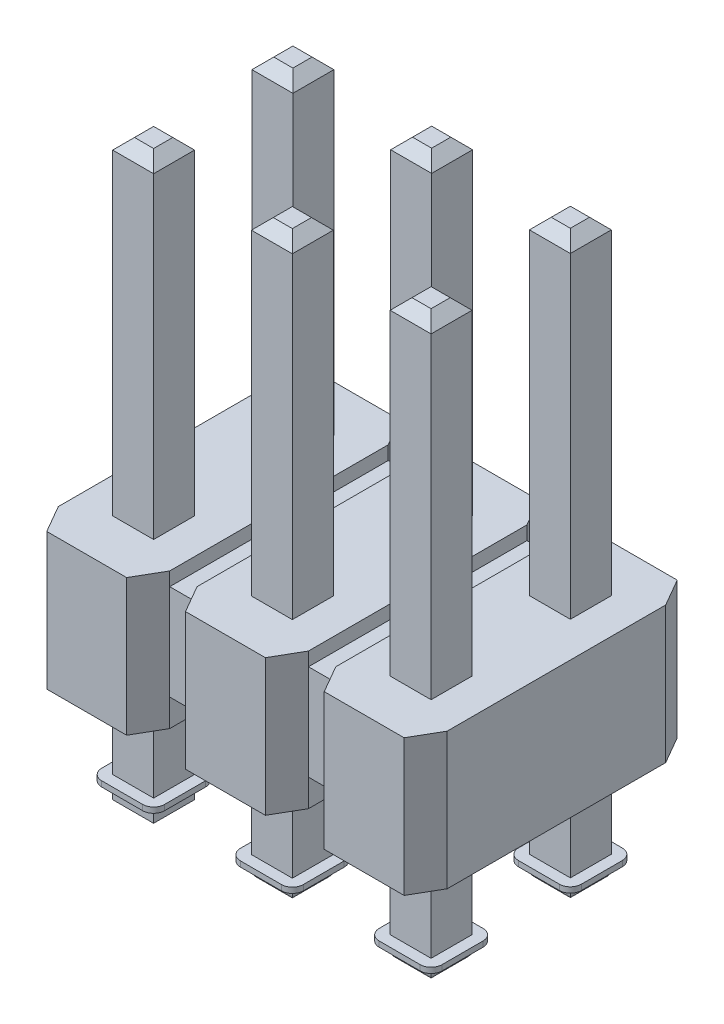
SolidWorks part; units mm, degrees
ref_plane "Plan de face" through (0, 0, 0) normal (0, 0, 1) x (1, 0, 0)
ref_plane "Plan de dessus" through (0, 0, 0) normal (0, 1, 0) x (1, 0, 0)
ref_plane "Plan de droite" through (0, 0, 0) normal (1, 0, 0) x (0, 0, -1)
sketch "Esquisse1" plane through (0, 0, 0) normal (0, 1, 0) x (1, 0, 0)
  line L0 (-0.7313, -2.5) -> (0.7313, -2.5)
  line L1 (0.7313, -2.5) -> (1.02, -2)
  line L2 (1.02, -2) -> (1.02, 2)
  line L3 (1.02, 2) -> (0.7313, 2.5)
  line L4 (0.7313, 2.5) -> (-0.7313, 2.5)
  line L5 (-0.7313, 2.5) -> (-1.02, 2)
  line L6 (-1.02, 2) -> (-1.02, -2)
  line L7 (-1.02, -2) -> (-0.7313, -2.5)
  point P8 (-1.02, 0)
  point P10 (0, -2.5)
  dimension "D1" = 2.04
  dimension "D2" = 5
  dimension "D3" = 150
  dimension "D4" = 150
  dimension "D5" = 150
  dimension "D6" = 150
  dimension "D7" = 0.5
  dimension "D8" = 0.5
extrude "Boss.-Extru.1" add sketch "Esquisse1" along normal blind 2.5
sketch "Esquisse2" plane through (0, 2.5, 0) normal (0, 1, 0) x (1, 0, 0)
  line L0 (0, 0.9) -> (0, -0.9) construction
  line L1 (-0.375, 1.65) -> (0.375, 1.65)
  line L2 (-0.375, 1.65) -> (-0.375, 0.9)
  line L3 (-0.375, 0.9) -> (0.375, 0.9)
  line L4 (0.375, 1.65) -> (0.375, 0.9)
  line L5 (-0.375, -0.9) -> (0.375, -0.9)
  line L6 (-0.375, -0.9) -> (-0.375, -1.65)
  line L7 (-0.375, -1.65) -> (0.375, -1.65)
  line L8 (0.375, -0.9) -> (0.375, -1.65)
  point P10 (0, 0)
  dimension "D1" = 0.75
  dimension "D2" = 1.8
extrude "Boss.-Extru.2" add sketch "Esquisse2" along normal blind 6
sketch "Esquisse3" plane through (0, 0, 0) normal (0, -1, 0) x (1, 0, 0)
  line L1 (-0.375, 1.65) -> (0.375, 1.65)
  line L2 (-0.375, 1.65) -> (-0.375, 0.9)
  line L3 (-0.375, 0.9) -> (0.375, 0.9)
  line L4 (0.375, 1.65) -> (0.375, 0.9)
  line L5 (-0.375, -0.9) -> (0.375, -0.9)
  line L6 (-0.375, -0.9) -> (-0.375, -1.65)
  line L7 (-0.375, -1.65) -> (0.375, -1.65)
  line L8 (0.375, -0.9) -> (0.375, -1.65)
extrude "Boss.-Extru.3" add sketch "Esquisse3" along normal blind 1.6
sketch "Esquisse4" plane through (-1.02, 0, 0) normal (-1, 0, 0) x (0, 0, 1)
  line L0 (-2, 2.5) -> (-2, 0) construction
  line L1 (-2, 2.25) -> (2, 2.25)
  line L2 (-2, 2.25) -> (-2, 0.5)
  line L3 (-2, 0.5) -> (2, 0.5)
  line L4 (2, 2.25) -> (2, 0.5)
  line L5 (2, 2.5) -> (2, 0) construction
  line L6 (-2, 2.5) -> (2, 2.5) construction
  line L7 (-2, 0) -> (2, 0) construction
  dimension "D1" = 0.25
  dimension "D2" = 0.5
extrude "Boss.-Extru.4" add sketch "Esquisse4" along normal blind 0.25
sketch "Esquisse5" plane through (1.02, 0, 0) normal (1, 0, 0) x (0, 0, -1)
  line L1 (-2, 2.25) -> (2, 2.25)
  line L2 (-2, 2.25) -> (-2, 0.5)
  line L3 (-2, 0.5) -> (2, 0.5)
  line L4 (2, 2.25) -> (2, 0.5)
extrude "Boss.-Extru.5" add sketch "Esquisse5" along normal blind 0.25
chamfer "Chanfrein2" distance 0.2 angle 45 8 edges at (0, 8.5, -0.9) (-0.375, 8.5, -1.275) (0, 8.5, -1.65) (0.375, 8.5, -1.275) (0, 8.5, 1.65) (-0.375, 8.5, 1.275) (0, 8.5, 0.9) (0.375, 8.5, 1.275)
sketch "Esquisse6" plane through (0, -1.6, 0) normal (0, -1, 0) x (1, 0, 0)
  line L1 (-0.375, 1.85) -> (0.375, 1.85)
  line L2 (-0.575, 1.65) -> (-0.575, 0.9)
  line L3 (-0.375, 0.7) -> (0.375, 0.7)
  line L4 (0.575, 1.65) -> (0.575, 0.9)
  line L5 (-0.375, -0.7) -> (0.375, -0.7)
  line L6 (-0.575, -0.9) -> (-0.575, -1.65)
  line L7 (-0.375, -1.85) -> (0.375, -1.85)
  line L8 (0.575, -0.9) -> (0.575, -1.65)
  line L9 (-0.375, 1.65) -> (-0.575, 1.85) construction
  line L10 (-0.375, 0.9) -> (-0.575, 0.7) construction
  line L11 (-0.375, -0.9) -> (-0.575, -0.7) construction
  arc A0 (-0.575, -1.65) -> (-0.375, -1.85) centre (-0.375, -1.65) ccw
  arc A1 (0.375, -1.85) -> (0.575, -1.65) centre (0.375, -1.65) ccw
  arc A2 (0.575, -0.9) -> (0.375, -0.7) centre (0.375, -0.9) ccw
  arc A3 (-0.375, -0.7) -> (-0.575, -0.9) centre (-0.375, -0.9) ccw
  arc A4 (0.375, 1.85) -> (0.575, 1.65) centre (0.375, 1.65) cw
  arc A5 (0.575, 0.9) -> (0.375, 0.7) centre (0.375, 0.9) cw
  arc A6 (-0.375, 0.7) -> (-0.575, 0.9) centre (-0.375, 0.9) cw
  arc A7 (-0.575, 1.65) -> (-0.375, 1.85) centre (-0.375, 1.65) cw
  point P8 (0, 0.7)
  point P28 (0.575, 1.85)
  dimension "D2" = 0.2
  dimension "D1" = 1.15
extrude "Boss.-Extru.6" add sketch "Esquisse6" along normal blind 0.1
sketch "Esquisse7" plane through (0, -1.7, 0) normal (0, -1, 0) x (1, 0, 0)
  line L1 (-0.375, 1.65) -> (0.375, 1.65)
  line L2 (-0.375, 1.65) -> (-0.375, 0.9)
  line L3 (-0.375, 0.9) -> (0.375, 0.9)
  line L4 (0.375, 1.65) -> (0.375, 0.9)
  line L5 (-0.375, -0.9) -> (0.375, -0.9)
  line L6 (-0.375, -0.9) -> (-0.375, -1.65)
  line L7 (-0.375, -1.65) -> (0.375, -1.65)
  line L8 (0.375, -0.9) -> (0.375, -1.65)
extrude "Boss.-Extru.7" add sketch "Esquisse7" along normal blind 0.3
fillet "Congé1" radius 0.15 8 edges at (0.375, -2, -1.275) (0, -2, -1.65) (-0.375, -2, -1.275) (0, -2, -0.9) (0, -2, 0.9) (-0.375, -2, 1.275) (0, -2, 1.65) (0.375, -2, 1.275)
fillet "Congé2" radius 0.15 8 edges at (0, -1.7, -1.65) (-0.375, -1.7, -1.275) (0, -1.7, 0.9) (-0.375, -1.7, 1.275) (0.375, -1.7, -1.275) (0, -1.7, -0.9) (0.375, -1.7, 1.275) (0, -1.7, 1.65)
pattern_linear "Répétition linéaire4" count 2 spacing 2.54 along (1, 0, 0) of "Boss.-Extru.4"
pattern_linear "Répétition linéaire5" count 2 spacing 2.54 along (-1, 0, 0) of "Boss.-Extru.5"
pattern_linear "Répétition linéaire10" count 2 spacing 2.54 along (-1, 0, 0) of "Boss.-Extru.1"
pattern_linear "Répétition linéaire11" count 2 spacing 2.54 along (1, 0, 0) of "Boss.-Extru.1"
pattern_linear "Répétition linéaire12" count 2 spacing 2.54 along (-1, 0, 0) of "Boss.-Extru.2", "Boss.-Extru.3", "Chanfrein2"
pattern_linear "Répétition linéaire13" count 2 spacing 2.54 along (1, 0, 0) of "Répétition linéaire12", "Boss.-Extru.2", "Boss.-Extru.3", "Chanfrein2"
pattern_linear "Répétition linéaire14" count 2 spacing 2.54 along (-1, 0, 0) of "Boss.-Extru.6", "Boss.-Extru.7", "Congé2"
pattern_linear "Répétition linéaire16" count 2 spacing 2.54 along (1, 0, 0) of "Boss.-Extru.6", "Boss.-Extru.7", "Congé1", "Congé2"
